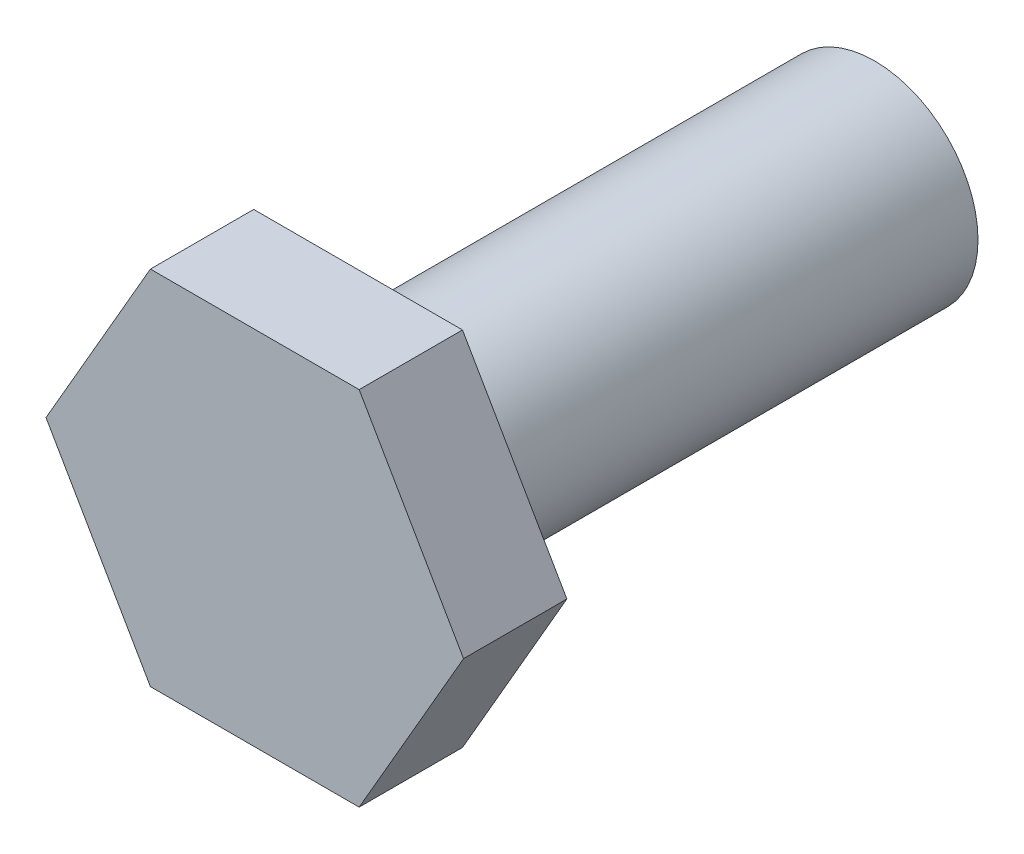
SolidWorks part; units mm, degrees
ref_plane "Front" through (0, 0, 0) normal (0, 0, 1) x (1, 0, 0)
ref_plane "Top" through (0, 0, 0) normal (0, 1, 0) x (1, 0, 0)
ref_plane "Right" through (0, 0, 0) normal (1, 0, 0) x (0, 0, -1)
sketch "Sketch2" plane through (0, 0, 0) normal (0, 0, 1) x (1, 0, 0)
  line L1 (27.9663, 23.495) -> (22.8337, 23.495)
  line L2 (22.8337, 23.495) -> (20.2674, 19.05)
  line L3 (20.2674, 19.05) -> (22.8337, 14.605)
  line L4 (22.8337, 14.605) -> (27.9663, 14.605)
  line L5 (27.9663, 14.605) -> (30.5326, 19.05)
  line L6 (30.5326, 19.05) -> (27.9663, 23.495)
  circle A0 centre (25.4, 19.05) radius 4.445 construction
  dimension "D1" = 8.89
extrude "Extrude1" add sketch "Sketch2" along normal blind 2.54
sketch "Sketch3" plane through (0, 0, 0) normal (0, 0, -1) x (-1, 0, 0)
  circle A0 centre (-25.4, 19.05) radius 2.54
  dimension "D1" = 5.08
extrude "Extrude2" add sketch "Sketch3" along normal blind 12.7
